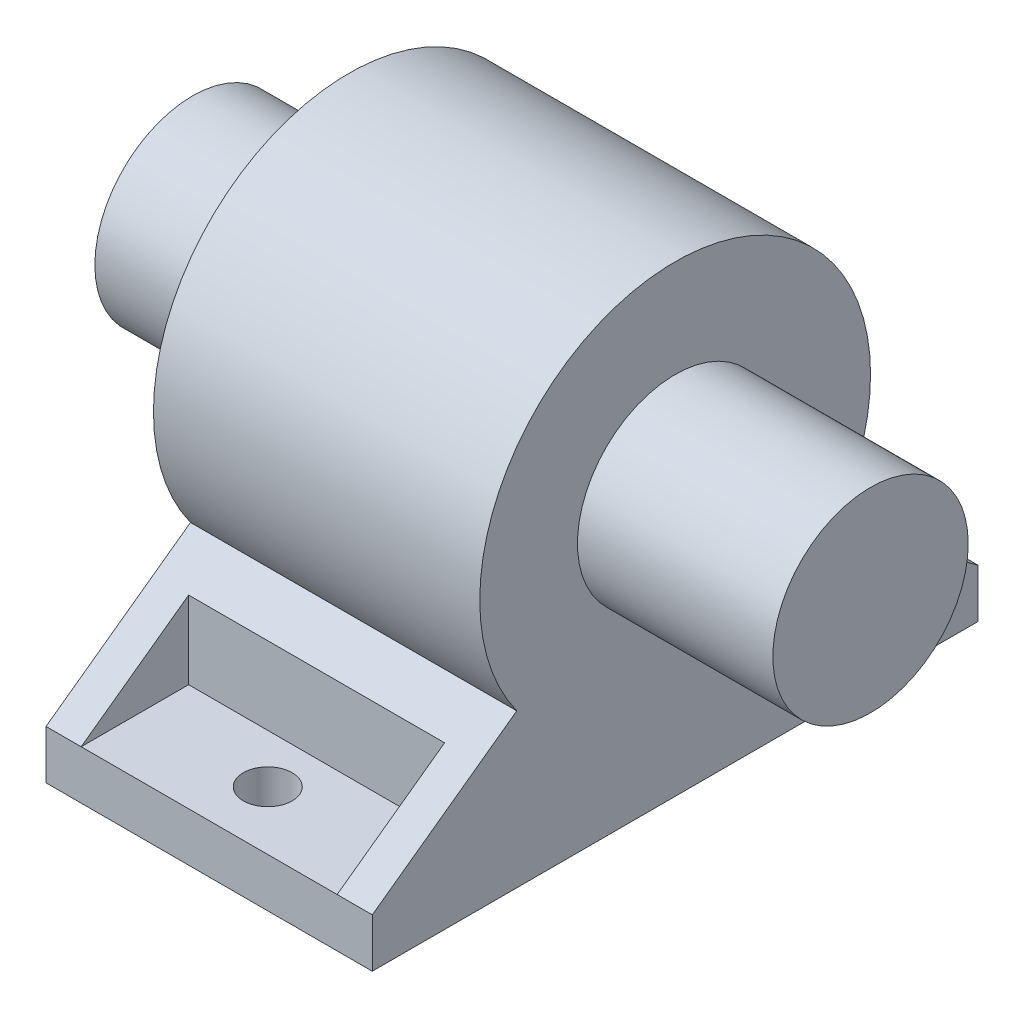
SolidWorks part; units mm, degrees
ref_plane "Front Plane" through (0, 0, 0) normal (0, 0, 1) x (1, 0, 0)
ref_plane "Top Plane" through (0, 0, 0) normal (0, 1, 0) x (1, 0, 0)
ref_plane "Right Plane" through (0, 0, 0) normal (1, 0, 0) x (0, 0, -1)
sketch "Sketch1" plane through (0, 0, 0) normal (1, 0, 0) x (0, 0, -1)
  line L0 (-39.37, -34.798) -> (39.37, -34.798)
  line L1 (39.37, -34.798) -> (39.37, -28.448)
  line L2 (39.37, -28.448) -> (20.5877, -14.8763)
  line L3 (-20.5877, -14.8763) -> (-39.37, -28.448)
  line L4 (-39.37, -28.448) -> (-39.37, -34.798)
  arc A0 (20.5877, -14.8763) -> (-20.5877, -14.8763) centre (0, 0) ccw
  point P5 (0, -34.798)
  dimension "D1" = 50.8
  dimension "D2" = 34.798
  dimension "D3" = 78.74
  dimension "D4" = 6.35
extrude "Boss-Extrude1" add sketch "Sketch1" along normal blind 42.418
sketch "Sketch2" plane through (42.418, 0, 0) normal (1, 0, 0) x (0, 0, -1)
  circle A0 centre (0, 0) radius 12.7
extrude "Boss-Extrude2" add sketch "Sketch2" along normal blind 25.4
sketch "Sketch3" plane through (0, 0, 0) normal (-1, 0, 0) x (0, 0, 1)
  circle A0 centre (0, 0) radius 12.7
extrude "Boss-Extrude3" add sketch "Sketch3" along normal blind 20.32
sketch "Sketch4" plane through (0, 0, 0) normal (0, 1, 0) x (1, 0, 0)
  line L0 (42.418, -39.37) -> (0, -39.37) construction
  line L1 (4.572, -39.37) -> (37.846, -39.37)
  line L2 (4.572, -39.37) -> (4.572, -25.4)
  line L3 (4.572, -25.4) -> (37.846, -25.4)
  line L4 (37.846, -39.37) -> (37.846, -25.4)
  line L5 (0, -25.4) -> (42.418, -25.4) construction
  line L6 (42.418, 39.37) -> (0, 39.37) construction
  line L7 (4.572, 39.37) -> (37.846, 39.37)
  line L8 (4.572, 39.37) -> (4.572, 25.4)
  line L9 (4.572, 25.4) -> (37.846, 25.4)
  line L10 (37.846, 39.37) -> (37.846, 25.4)
  line L11 (42.418, 25.4) -> (0, 25.4) construction
  line L12 (0, 39.37) -> (0, 20.5877) construction
  line L13 (42.418, 39.37) -> (42.418, 20.5877) construction
  dimension "D1" = 4.572
  dimension "D2" = 4.572
extrude "Cut-Extrude1" cut sketch "Sketch4" against normal offset from surface (28.448 mm away) 6.35
sketch "Sketch5" plane through (0, 0, 0) normal (0, 1, 0) x (1, 0, 0)
  line L0 (4.572, 39.37) -> (37.846, 39.37) construction
  circle A0 centre (21.209, 31.75) radius 3.175
  circle A1 centre (21.209, -31.75) radius 3.175
  point P9 (21.209, 39.37)
  dimension "D1" = 6.35
  dimension "D2" = 31.75
  dimension "D3" = 31.75
extrude "Mount Holes" cut sketch "Sketch5" against normal through all both and the other way through all
